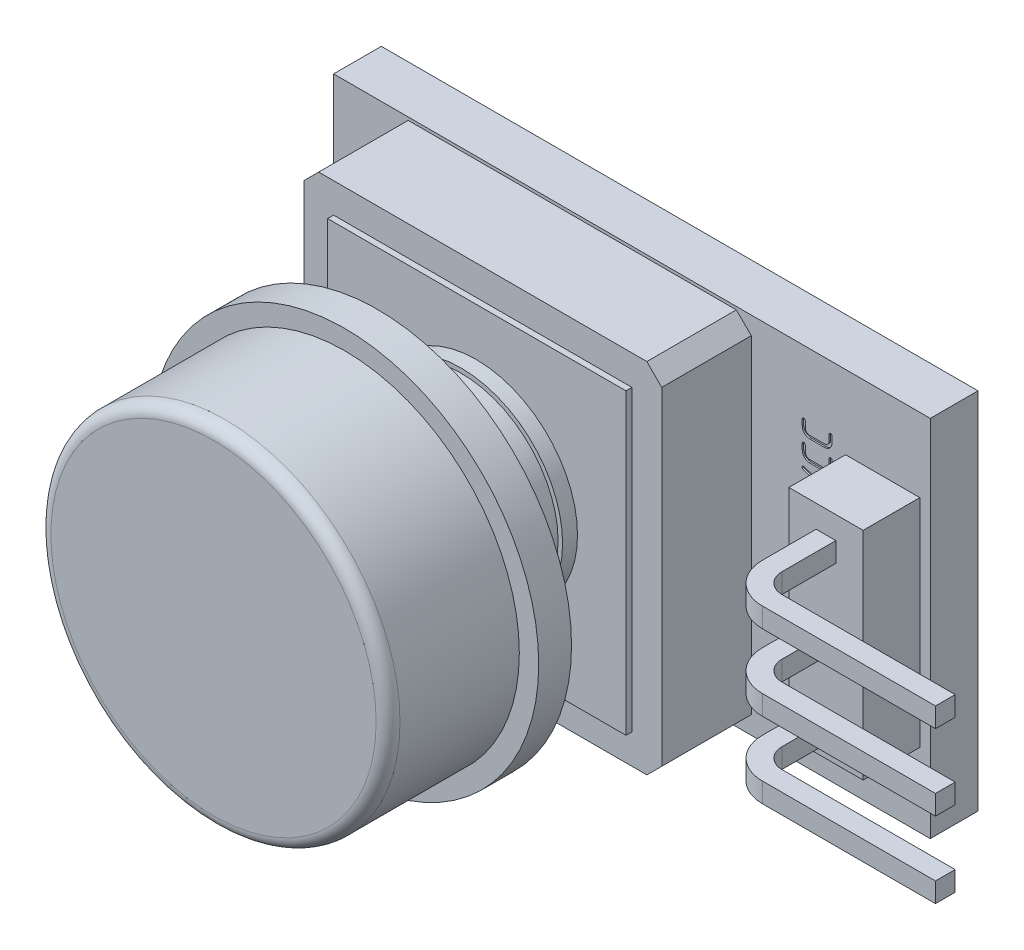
SolidWorks part; units mm, degrees
ref_plane "Top" through (0, 0, 0) normal (0, 0, 1) x (1, 0, 0)
ref_plane "Front" through (0, 0, 0) normal (0, 1, 0) x (1, 0, 0)
ref_plane "Side" through (0, 0, 0) normal (1, 0, 0) x (0, 0, -1)
sketch "Sketch1" plane through (0, 0, 0) normal (0, 0, 1) x (1, 0, 0)
  line L0 (0, 0) -> (7, 0) construction
  line L1 (-13, 6.1) -> (7, 6.1)
  line L2 (-13, 6.1) -> (-13, -6.1)
  line L3 (-13, -6.1) -> (7, -6.1)
  line L4 (7, 6.1) -> (7, -6.1)
  dimension "D1" = 7
  dimension "D2" = 12.2
  dimension "D4" = 20
extrude "Boss-Extrude1" add sketch "Sketch1" against normal blind 1.6
sketch "Sketch5" plane through (0, 0, 0) normal (0, 0, 1) x (1, 0, 0)
  line L0 (0, 0) -> (4.16, 0) construction
  line L1 (4.16, 3.625) -> (6.65, 3.625)
  line L2 (4.16, 3.625) -> (4.16, -3.625)
  line L3 (4.16, -3.625) -> (6.65, -3.625)
  line L4 (6.65, 3.625) -> (6.65, -3.625)
  line L5 (7, -6.1) -> (7, 6.1) construction
  dimension "D1" = 7.25
  dimension "D2" = 2.49
  dimension "D3" = 0.35
extrude "Boss-Extrude3" add sketch "Sketch5" along normal blind 1.9 separate body
sketch "Sketch6" plane through (0, 0, 0) normal (0, 1, 0) x (1, 0, 0)
  line L0 (4.16, -1.9) -> (6.65, -1.9) construction
  line L2 (5.405, -3.7) -> (5.405, 2.6)
  line L3 (6.405, -4.7) -> (12.205, -4.7)
  line L4 (-13, 1.6) -> (7, 1.6) construction
  arc A0 (5.405, -3.7) -> (6.405, -4.7) centre (6.405, -3.7) ccw
  point P0 (5.405, -1.9)
  dimension "D1" = 6.8
  dimension "D3" = 1
  dimension "D2" = 6.3
  dimension "D4" = 1
extrude "Extrude-Thin1" add sketch "Sketch6" along normal mid plane 0.66 separate body thin
pattern_linear "LPattern1" count 2 spacing 2.54 along (0, 1, 0) count 2 spacing 2.54 along (0, -1, 0)
ref_plane "Plane1" through (0, 4, 0) normal (0, 1, 0) x (1, 0, 0)
ref_plane "Plane2" through (0, 5.27, 0) normal (0, 1, 0) x (1, 0, 0)
sketch "Sketch14" plane through (0, 0, 0) normal (0, 0, 1) x (1, 0, 0)
  line L0 (3.7088, -4.2553) -> (3.7088, 3.895) construction
  text T0 "OUT GND VCC" font "DS ISO 1" height 1
extrude "Cut-Extrude3" cut sketch "Sketch14" against normal blind 0.05
sketch "Esquisse1" plane through (0, 0, 0) normal (0, 0, 1) x (1, 0, 0)
  line L0 (0, 0) -> (-8.5641, 0) construction
  line L1 (-10.5, 6) -> (0.5, 6)
  line L2 (-11, 5.5) -> (-11, -5.5)
  line L3 (-10.5, -6) -> (0.5, -6)
  line L4 (1, 5.5) -> (1, -5.5)
  line L5 (-11, 6) -> (1, -6) construction
  line L6 (-11, -6) -> (1, 6) construction
  line L7 (7, -6.1) -> (7, 6.1) construction
  line L8 (-11, 5.5) -> (-10.5, 6)
  line L9 (0.5, 6) -> (1, 5.5)
  line L10 (0.5, -6) -> (1, -5.5)
  line L11 (-11, -5.5) -> (-10.5, -6)
  point P0 (-5, 0)
  dimension "D1" = 12
  dimension "D2" = 12
  dimension "D3" = 6
extrude "Boss.-Extru.1" add sketch "Esquisse1" along normal blind 3
sketch "Esquisse2" plane through (0, 0, 3) normal (0, 0, 1) x (1, 0, 0)
  line L0 (-11, 5.5) -> (-10.5, 6) construction
  line L1 (-10.5, 6) -> (0.5, 6) construction
  line L2 (0.5, 6) -> (1, 5.5) construction
  line L3 (1, 5.5) -> (1, -5.5) construction
  line L4 (1, -5.5) -> (0.5, -6) construction
  line L5 (0.5, -6) -> (-10.5, -6) construction
  line L6 (-10.5, -6) -> (-11, -5.5) construction
  line L7 (-11, -5.5) -> (-11, 5.5) construction
  line L8 (-10, 5) -> (-10, 5)
  line L9 (-10, 5) -> (0, 5)
  line L10 (0, 5) -> (0, 5)
  line L11 (0, 5) -> (0, -5)
  line L12 (0, -5) -> (0, -5)
  line L13 (0, -5) -> (-10, -5)
  line L14 (-10, -5) -> (-10, -5)
  line L15 (-10, -5) -> (-10, 5)
  dimension "D1" = 1
extrude "Boss.-Extru.2" add sketch "Esquisse2" along normal blind 0.2
sketch "Esquisse3" plane through (0, 0, 3.2) normal (0, 0, 1) x (1, 0, 0)
  circle A0 centre (-5.0244, 0) radius 3.4
  dimension "D1" = 6.8
extrude "Boss.-Extru.3" add sketch "Esquisse3" along normal blind 0.5
sketch "Esquisse4" plane through (0, 0, 0) normal (0, 1, 0) x (1, 0, 0)
  line L0 (-5.0244, -3.7) -> (-1.7744, -3.7)
  line L1 (-8.4244, -3.7) -> (-1.6244, -3.7) construction
  line L2 (-1.7744, -3.7) -> (-1.7744, -6.5)
  line L3 (-1.7744, -6.5) -> (1.4756, -6.5)
  line L4 (1.4756, -6.5) -> (1.4756, -7.6)
  line L5 (1.4756, -7.6) -> (0.8256, -7.6)
  line L6 (0.8256, -7.6) -> (0.8256, -11.6)
  line L7 (0.4256, -12) -> (-5.0244, -12)
  line L8 (-5.0244, -12) -> (-5.0244, -3.7)
  arc A0 (0.8256, -11.6) -> (0.4256, -12) centre (0.4256, -11.6) cw
  point P13 (0.8256, -12)
  dimension "D7" = 0.4
  dimension "D1" = 3.25
  dimension "D2" = 2.8
  dimension "D3" = 1.1
  dimension "D4" = 6.5
  dimension "D5" = 5.85
  dimension "D6" = 4.4
revolve "Révolution1" add sketch "Esquisse4" angle 360 about L8
sketch "Esquisse5" plane through (0, 0, -1.6) normal (0, 0, -1) x (-1, 0, 0)
  line L1 (-3.6543, 5.5026) -> (-1.6938, 5.5026)
  line L2 (-3.6543, 5.5026) -> (-3.6543, 4.3263)
  line L3 (-3.6543, 4.3263) -> (-1.6938, 4.3263)
  line L4 (-1.6938, 5.5026) -> (-1.6938, 4.3263)
extrude "Boss.-Extru.4" add sketch "Esquisse5" along normal blind 0.5
sketch "Esquisse6" plane through (0, 0, -1.6) normal (0, 0, -1) x (-1, 0, 0)
  text T0 "R1" font "Century Gothic" height 1
extrude "Boss.-Extru.5" add sketch "Esquisse6" along normal blind 0.1
